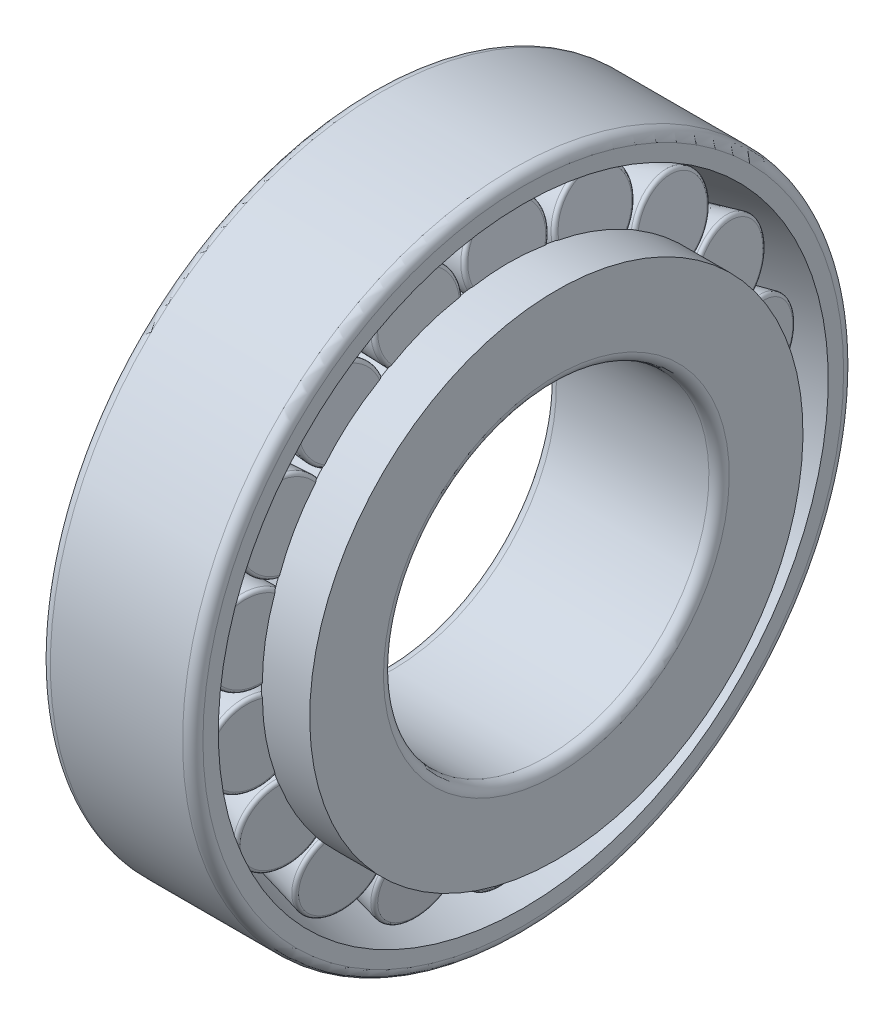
SolidWorks part; units mm, degrees
ref_plane "Front" through (0, 0, 0) normal (0, 0, 1) x (1, 0, 0)
ref_plane "Top" through (0, 0, 0) normal (0, 1, 0) x (1, 0, 0)
ref_plane "Right" through (0, 0, 0) normal (1, 0, 0) x (0, 0, -1)
sketch "Sketch1" plane through (0, 0, 0) normal (0, 0, 1) x (1, 0, 0)
  line L0 (10.753, 0) -> (13.9916, 0) construction
  line L1 (7.5, 29.9899) -> (7.5, 31.5)
  line L2 (6.5, 32.5) -> (-6.5, 32.5)
  line L3 (-7.5, 31.5) -> (-7.5, 26.25)
  line L4 (-7.5, 26.25) -> (7.5, 29.9899)
  line L5 (-6.247, 17) -> (-6.247, 22.0124)
  line L6 (-5.247, 16) -> (9.753, 16)
  line L7 (10.753, 17) -> (10.753, 24.2704)
  line L8 (-4.3401, 20.5124) -> (-5.3344, 26.79)
  line L9 (6.5, 21.2704) -> (5.2094, 29.4188)
  line L10 (-4.8372, 23.6512) -> (5.8547, 25.3446) construction
  line L11 (-4.3401, 20.5124) -> (6.5, 21.2704)
  line L12 (6.0248, 24.25) -> (10.753, 24.25)
  line L13 (10.753, 24.2704) -> (6.0248, 24.2704)
  line L14 (-6.247, 22.0124) -> (-4.5777, 22.0124)
  arc A0 (-6.5, 32.5) -> (-7.5, 31.5) centre (-6.5, 31.5) ccw
  arc A1 (7.5, 31.5) -> (6.5, 32.5) centre (6.5, 31.5) ccw
  arc A2 (-5.247, 16) -> (-6.247, 17) centre (-5.247, 17) cw
  arc A3 (9.753, 16) -> (10.753, 17) centre (9.753, 17) ccw
  point P19 (-7.5, 32.5)
  point P22 (7.5, 32.5)
  point P24 (0, 32.5)
  point P29 (-6.247, 16)
  point P32 (10.753, 16)
  dimension "XR12" = 1
  dimension "XR34" = 1
  dimension "D1" = 16.0874
  dimension "DD" = 65
  dimension "D2" = 4.253
  dimension "DT" = 18.253
  dimension "D3" = 3
  dimension "DE" = 52.5
  dimension "D4" = 1.5
  dimension "DC" = 15
  dimension "XD" = 32
  dimension "D7" = 5
  dimension "gzzj" = 8.25
  dimension "DB" = 17
  dimension "XALF" = 14
  dimension "ZJ" = 48.5
revolve "Revolve1" add sketch "Sketch1" angle 360 about L0
sketch "Sketch2" plane through (0, 0, 0) normal (0, 0, 1) x (1, 0, 0)
  line L0 (-4.857, 23.648) -> (9.3992, 25.906) construction
  line L4 (-4.8372, 23.6512) -> (5.8547, 25.3446) construction
  line L5 (-4.857, 23.648) -> (5.8745, 25.3477)
  line L7 (-5.3541, 26.7868) -> (-4.357, 20.4911)
  line L8 (6.5232, 21.252) -> (5.2292, 29.4219)
  line L9 (-4.357, 20.4911) -> (6.5232, 21.252)
  line L10 (-4.857, 23.648) -> (-4.4043, 20.7898)
  line L11 (6.4668, 21.6077) -> (5.8745, 25.3477)
  line L12 (-4.0553, 20.5122) -> (6.1639, 21.2268)
  arc A0 (-4.0553, 20.5122) -> (-4.4043, 20.7898) centre (-4.0783, 20.8414) cw
  arc A1 (6.1639, 21.2268) -> (6.4668, 21.6077) centre (6.1409, 21.556) ccw
  dimension "D2" = 0.33
  dimension "D1" = 0.02
revolve "Revolve2" add sketch "Sketch2" angle 360 about L0
sketch "Sketch3" plane through (0, 0, 0) normal (0, 0, 1) x (1, 0, 0)
  line L0 (-7.5, 26.25) -> (7.5, 29.9899) construction
  line L1 (-7.5, 31.5) -> (-7.5, 26.25) construction
  line L2 (6.5, 32.5) -> (-6.5, 32.5) construction
  line L3 (7.5, 29.9899) -> (7.5, 31.5) construction
  line L4 (-7.5, 26.25) -> (7.5, 29.9899)
  line L5 (-7.5, 31.5) -> (-7.5, 26.25)
  line L6 (6.5, 32.5) -> (-6.5, 32.5)
  line L7 (7.5, 29.9899) -> (7.5, 31.5)
  arc A0 (-6.5, 32.5) -> (-7.5, 31.5) centre (-6.5, 31.5) ccw construction
  arc A1 (7.5, 31.5) -> (6.5, 32.5) centre (6.5, 31.5) ccw construction
  arc A2 (-6.5, 32.5) -> (-7.5, 31.5) centre (-6.5, 31.5) ccw
  arc A3 (7.5, 31.5) -> (6.5, 32.5) centre (6.5, 31.5) ccw
revolve "Revolve3" add sketch "Sketch3" angle 360 about axis through (10.753, 0, 0) along (1, 0, 0)
pattern_circular "Circular-Pattern1" count 18 over 360 about axis through (0, 0, 0) along (1, 0, 0) of "Revolve2"
equation "\"gzzj@Sketch1\" =  ( \"DD@Sketch1\" - \"XD@Sketch1\" )  / 4"
equation "\"D1@Sketch1\" = \"DB@Sketch1\" - \"DT@Sketch1\" / 20"
equation "\"D2@Sketch1\" = \"DT@Sketch1\" - \"DC@Sketch1\" + \"XR12@Sketch1\""
equation "\"D4@Sketch1\" = \"D3@Sketch1\" / 2"
equation "\"D2@Sketch2\" = \"gzzj@Sketch1\" / 25"
equation "\"ZJ@Sketch1\" =  ( \"DD@Sketch1\" + \"XD@Sketch1\" )  / 2"
equation "\"D1@Circular-Pattern1\" = int( 3.14159265 / atn(( \"gzzj@Sketch1\" / 2) / sqr( \"ZJ@Sketch1\" * \"ZJ@Sketch1\" /4 - ( \"gzzj@Sketch1\"/ 2) *  ( \"gzzj@Sketch1\"/ 2))))"
